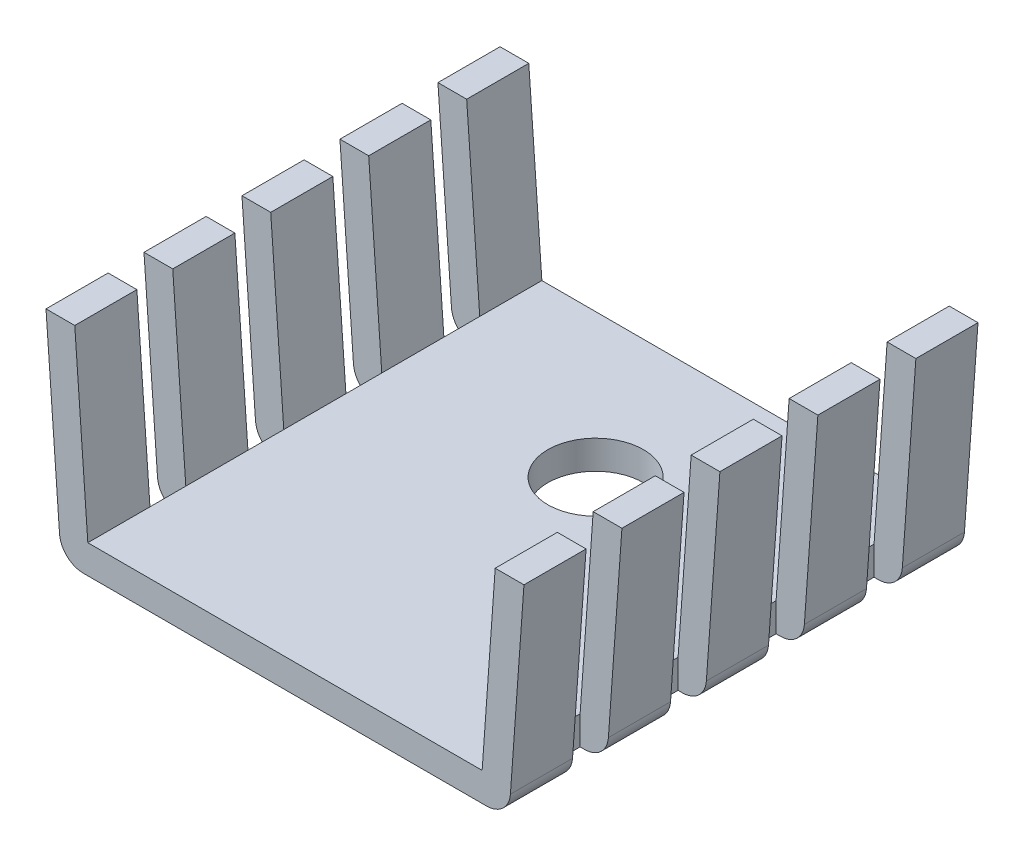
SolidWorks part; units mm, degrees
ref_plane "Plan de face" through (0, 0, 0) normal (0, 0, 1) x (1, 0, 0)
ref_plane "Plan de dessus" through (0, 0, 0) normal (0, 1, 0) x (1, 0, 0)
ref_plane "Plan de droite" through (0, 0, 0) normal (1, 0, 0) x (0, 0, -1)
sketch "Esquisse1" plane through (0, 0, 0) normal (0, 0, 1) x (1, 0, 0)
  line L0 (0, -8.9226) -> (0, 19.477) construction
  line L1 (-16.285, 0) -> (25.335, 0) construction
  line L2 (-8.25, -14.7983) -> (-8.25, 5.5122) construction
  line L3 (8.25, -14.7983) -> (8.25, 6.5722) construction
  line L4 (10, 29.7596) -> (10, -3.3027) construction
  line L5 (-10, 29.7596) -> (-10, -5.2598) construction
  line L6 (-16.285, 8.8) -> (25.335, 8.8) construction
  line L7 (-11.5905, 1.2) -> (15.2494, 1.2) construction
  line L8 (8.8329, 9.3006) -> (8.25, 1.2) construction
  line L9 (10, 8.8) -> (9.2961, -0.9824) construction
  line L10 (8.25, 1.2) -> (8.7969, 8.8)
  line L11 (8.7969, 8.8) -> (10, 8.8)
  line L12 (10, 8.8) -> (9.4335, 0.9282)
  line L13 (-8.7969, 8.8) -> (-10, 8.8)
  line L14 (-10, 8.8) -> (-9.4335, 0.9282)
  line L15 (-8.25, 1.2) -> (-8.7969, 8.8)
  line L16 (-8.25, 1.2) -> (8.25, 1.2)
  line L17 (-8.4361, 0) -> (8.4361, 0)
  arc A0 (-9.4335, 0.9282) -> (-8.4361, 0) centre (-8.4361, 1) ccw
  arc A1 (9.4335, 0.9282) -> (8.4361, 0) centre (8.4361, 1) cw
  point P29 (-9.3668, 0)
  point P32 (9.3668, 0)
  dimension "D8" = 1
  dimension "D1" = 8.25
  dimension "D2" = 16.5
  dimension "D3" = 10
  dimension "D4" = 20
  dimension "D5" = 8.8
  dimension "D6" = 1.2
  dimension "D7" = 1.2
extrude "Boss.-Extru.1" add sketch "Esquisse1" along normal blind 19
ref_plane "Plan1" through (0, 0, 0) normal (1, 0, 0) x (0, 0, -1)
sketch "Esquisse2" plane through (0, 0, 0) normal (1, 0, 0) x (0, 0, -1)
  line L0 (-20.2157, 0) -> (3.005, 0) construction
  line L1 (-20.2157, 1.2) -> (3.005, 1.2) construction
  line L2 (-19, -1.9745) -> (-19, 11.8115) construction
  line L3 (-9.5, -1.9745) -> (-9.5, 11.8115) construction
  line L4 (-16.4, 10.5712) -> (-16.4, -1.9745) construction
  line L5 (-14.9, 10.5712) -> (-14.9, -1.9745) construction
  line L6 (-12.3, 10.5712) -> (-12.3, -1.9745) construction
  line L7 (-10.8, 10.5712) -> (-10.8, -1.9745) construction
  line L8 (-8.2, 9.219) -> (-8.2, 1.2)
  line L9 (-16.4, 9.219) -> (-14.9, 9.219)
  line L10 (-16.4, 9.219) -> (-16.4, 1.2)
  line L11 (-16.4, 1.2) -> (-14.9, 1.2)
  line L12 (-14.9, 9.219) -> (-14.9, 1.2)
  line L13 (-12.3, 9.219) -> (-10.8, 9.219)
  line L14 (-12.3, 9.219) -> (-12.3, 1.2)
  line L15 (-12.3, 1.2) -> (-10.8, 1.2)
  line L16 (-10.8, 9.219) -> (-10.8, 1.2)
  line L17 (-6.7, 1.2) -> (-8.2, 1.2)
  line L18 (-6.7, 9.219) -> (-6.7, 1.2)
  line L19 (-6.7, 9.219) -> (-8.2, 9.219)
  line L20 (-4.1, 9.219) -> (-4.1, 1.2)
  line L21 (-2.6, 1.2) -> (-4.1, 1.2)
  line L22 (-2.6, 9.219) -> (-2.6, 1.2)
  line L23 (-2.6, 9.219) -> (-4.1, 9.219)
  dimension "D1" = 1.2
  dimension "D2" = 9.5
  dimension "D3" = 2.6
  dimension "D4" = 2.6
  dimension "D5" = 1.5
  dimension "D6" = 1.5
extrude "Enlèv. mat.-Extru.1" cut sketch "Esquisse2" against normal mid plane 20
sketch "Esquisse3" plane through (0, 1.2, 0) normal (0, 1, 0) x (1, 0, 0)
  line L0 (11.7059, 0) -> (-10.9019, 0) construction
  line L1 (11.7059, -6) -> (-10.9019, -6) construction
  line L2 (0, 2.1197) -> (0, -7.2064) construction
  line L3 (0, -4.84) -> (0, 4.84) construction
  line L4 (8.25, 1.7338) -> (8.25, -19.4268) construction
  line L5 (6.6569, -2.6) -> (10.4517, -2.6) construction
  line L6 (6.6569, -4.1) -> (10.4517, -4.1) construction
  line L7 (8.25, -6.7) -> (8.25, -8.2)
  line L8 (8.25, -2.6) -> (9.8728, -2.6)
  line L9 (8.25, -2.6) -> (8.25, -4.1)
  line L10 (8.25, -4.1) -> (9.8728, -4.1)
  line L11 (9.8728, -2.6) -> (9.8728, -4.1)
  line L12 (8.25, -6.7) -> (9.8728, -6.7)
  line L13 (9.8728, -6.7) -> (9.8728, -8.2)
  line L14 (8.25, -8.2) -> (9.8728, -8.2)
  line L15 (8.25, -10.8) -> (8.25, -12.3)
  line L16 (8.25, -10.8) -> (9.8728, -10.8)
  line L17 (9.8728, -10.8) -> (9.8728, -12.3)
  line L18 (8.25, -12.3) -> (9.8728, -12.3)
  line L19 (8.25, -14.9) -> (8.25, -16.4)
  line L20 (8.25, -14.9) -> (9.8728, -14.9)
  line L21 (9.8728, -14.9) -> (9.8728, -16.4)
  line L22 (8.25, -16.4) -> (9.8728, -16.4)
  line L23 (-8.25, -16.4) -> (-9.8728, -16.4)
  line L24 (-9.8728, -14.9) -> (-9.8728, -16.4)
  line L25 (-8.25, -14.9) -> (-9.8728, -14.9)
  line L26 (-8.25, -14.9) -> (-8.25, -16.4)
  line L27 (-8.25, -12.3) -> (-9.8728, -12.3)
  line L28 (-9.8728, -10.8) -> (-9.8728, -12.3)
  line L29 (-8.25, -10.8) -> (-9.8728, -10.8)
  line L30 (-8.25, -10.8) -> (-8.25, -12.3)
  line L31 (-8.25, -8.2) -> (-9.8728, -8.2)
  line L32 (-9.8728, -6.7) -> (-9.8728, -8.2)
  line L33 (-8.25, -6.7) -> (-9.8728, -6.7)
  line L34 (-9.8728, -2.6) -> (-9.8728, -4.1)
  line L35 (-8.25, -4.1) -> (-9.8728, -4.1)
  line L36 (-8.25, -2.6) -> (-8.25, -4.1)
  line L37 (-8.25, -2.6) -> (-9.8728, -2.6)
  line L38 (-8.25, -6.7) -> (-8.25, -8.2)
  circle A0 centre (0, -6) radius 2
  dimension "D2" = 4
  dimension "D1" = 6
extrude "Enlèv. mat.-Extru.2" cut sketch "Esquisse3" against normal through all
